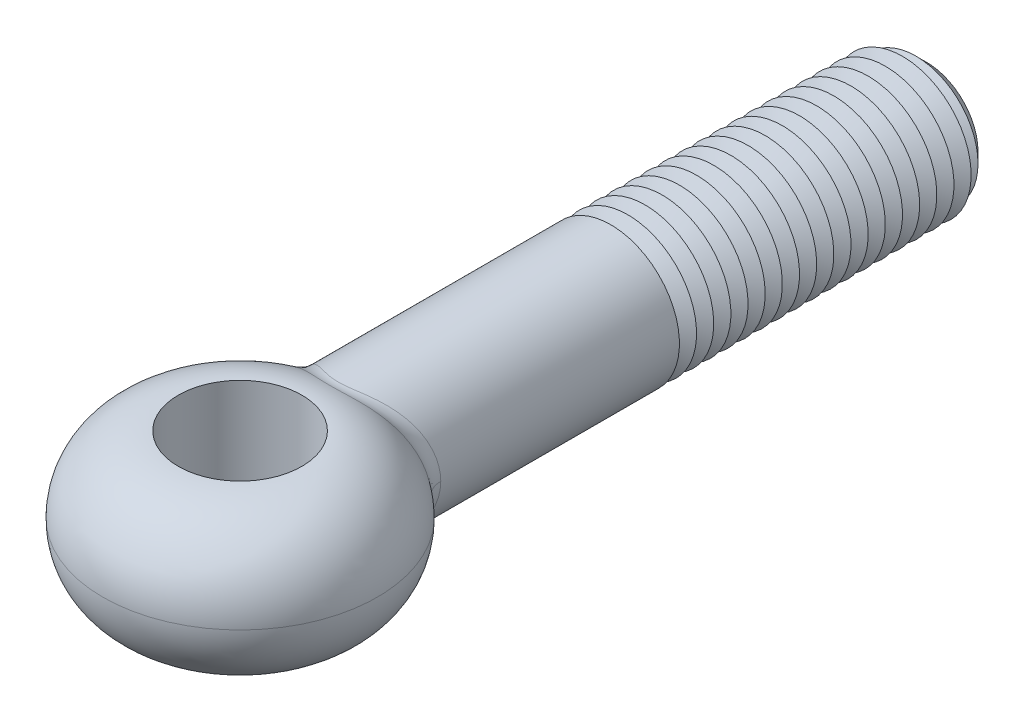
SolidWorks part; units mm, degrees
ref_plane "Front Plane" through (0, 0, 0) normal (0, 0, 1) x (1, 0, 0)
ref_plane "Top Plane" through (0, 0, 0) normal (0, 1, 0) x (1, 0, 0)
ref_plane "Right Plane" through (0, 0, 0) normal (1, 0, 0) x (0, 0, -1)
sketch "Sketch7" plane through (0, 0, 0) normal (0, 1, 0) x (1, 0, 0)
  circle A0 centre (0, 0) radius 20
  dimension "D1" = 40
extrude "Boss-Extrude3" add sketch "Sketch7" along normal mid plane 22
sketch "Sketch8" plane through (0, 0, 0) normal (0, 0, 1) x (1, 0, 0)
  circle A0 centre (0, 0) radius 10
  dimension "D1" = 20
extrude "Boss-Extrude4" add sketch "Sketch8" against normal blind 100
fillet "Fillet5" radius 11 2 edges at (0, -11, 20) (0, 11, 20)
fillet "Fillet6" radius 3.5 2 edges at (0.8553, -9.9634, -13.6349) (-0.8553, 9.9634, -13.6349)
chamfer "Chamfer1" distance 2.5 angle 45 1 edges at (10, 0, -100)
sketch "Sketch10" plane through (0, 0, 0) normal (0, 1, 0) x (1, 0, 0)
  line L0 (0, 28.1405) -> (0, -7.9233) construction
sketch "Sketch11" plane through (0, 0, 0) normal (0, 1, 0) x (1, 0, 0)
  line L0 (-10, 54) -> (-7.8349, 55.25)
  line L1 (-10, 97.5) -> (-10, 19.2354) construction
  line L2 (-7.8349, 55.25) -> (-10, 56.5)
  line L3 (-10, 56.5) -> (-10, 54)
  line L4 (7.5, 100) -> (-7.5, 100) construction
  dimension "D1" = 2.5
  dimension "D2" = 46
revolve "Cut-Revolve1" cut sketch "Sketch11" angle 360 about L0
pattern_linear "LPattern1" count 18 spacing 2.5 along (0, 0, -1) of "Cut-Revolve1"
sketch "Sketch12" plane through (0, 0, 0) normal (0, 1, 0) x (1, 0, 0)
  circle A0 centre (0, 0) radius 9
  dimension "D1" = 18
extrude "Cut-Extrude1" cut sketch "Sketch12" against normal mid plane 22
